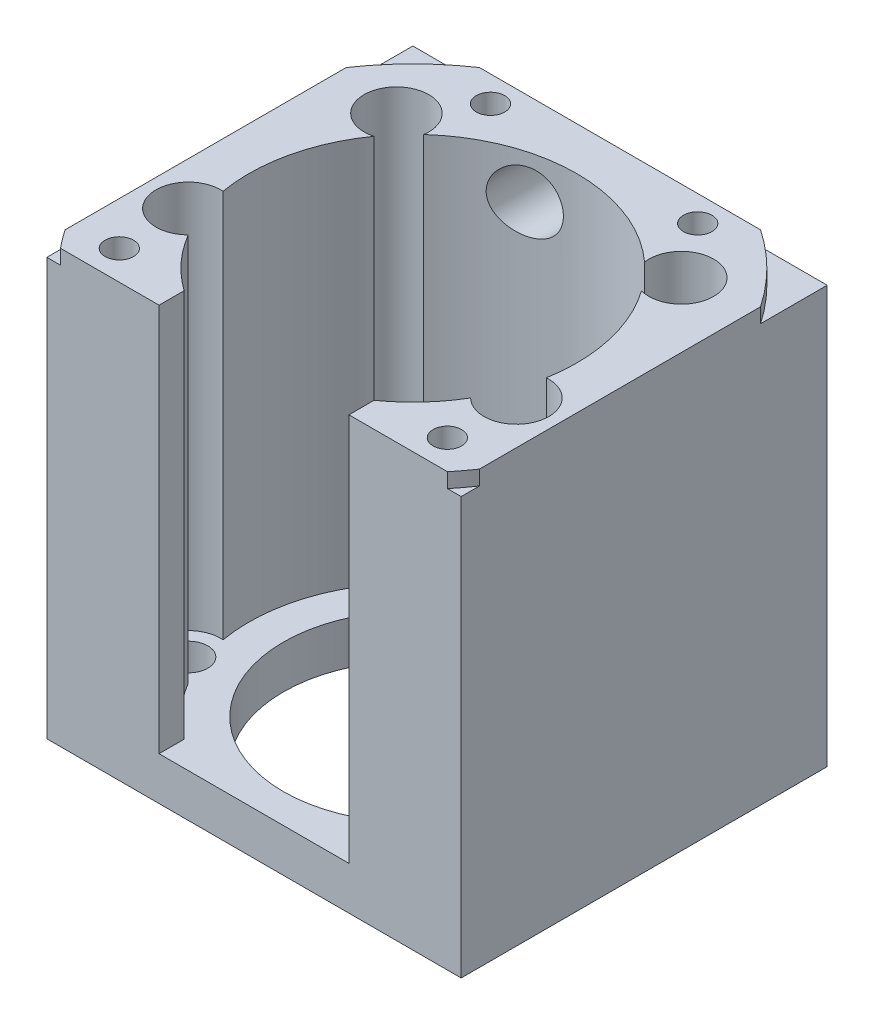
SolidWorks part; units mm, degrees
ref_plane "前视基准面" through (0, 0, 0) normal (0, 0, 1) x (1, 0, 0)
ref_plane "上视基准面" through (0, 0, 0) normal (0, 1, 0) x (1, 0, 0)
ref_plane "右视基准面" through (0, 0, 0) normal (1, 0, 0) x (0, 0, -1)
sketch "草图1" plane through (0, 0, 0) normal (0, 1, 0) x (1, 0, 0)
  line L1 (0, 0) -> (48, 0)
  line L2 (0, 0) -> (0, 42.4)
  line L3 (0, 42.4) -> (48, 42.4)
  line L4 (48, 0) -> (48, 42.4)
  dimension "D1" = 48
  dimension "D2" = 42.4
extrude "凸台-拉伸1" add sketch "草图1" along normal blind 50
sketch "草图2" plane through (0, 50, 0) normal (0, 1, 0) x (1, 0, 0)
  line L0 (24, 0) -> (24, 32.6408) construction
  line L1 (0, 0) -> (48, 0) construction
  circle A0 centre (24, 18.4) radius 15
  dimension "D1" = 18.4
  dimension "D2" = 30
extrude "切除-拉伸1" cut sketch "草图2" against normal blind 50
sketch "草图3" plane through (0, 50, 0) normal (0, 1, 0) x (1, 0, 0)
  circle A0 centre (24, 18.4) radius 19
  dimension "D1" = 38
extrude "切除-拉伸2" cut sketch "草图3" against normal blind 45
sketch "草图4" plane through (0, 50, 0) normal (0, 1, 0) x (1, 0, 0)
  line L0 (0, 0) -> (19.2629, 0) construction
  line L1 (13, 0) -> (35, 0)
  line L2 (13, 0) -> (13, 3.7953)
  line L3 (13, 3.7953) -> (35, 3.7953)
  line L4 (35, 0) -> (35, 3.7953)
  line L5 (24, 42.4) -> (24, -6.943) construction
  line L6 (48, 42.4) -> (0, 42.4) construction
  dimension "D1" = 22
extrude "切除-拉伸3" cut sketch "草图4" against normal blind 45
sketch "草图5" plane through (0, 50, 0) normal (0, 1, 0) x (1, 0, 0)
  line L0 (24, 42.4) -> (24, 18.4) construction
  line L1 (48, 42.4) -> (0, 42.4) construction
  line L2 (24, 18.4) -> (51.3541, 18.4) construction
  circle A0 centre (7.5, 33) radius 2.25
  circle A1 centre (5, 11.4) radius 2.25
  circle A2 centre (43, 11.4) radius 2.25
  circle A3 centre (40.5, 33) radius 2.25
  dimension "D1" = 14.6
  dimension "D2" = 4.5
  dimension "D3" = 33
  dimension "D4" = 7
  dimension "D5" = 38
extrude "切除-拉伸4" cut sketch "草图5" against normal blind 55
sketch "草图6" plane through (0, 50, 0) normal (0, 1, 0) x (1, 0, 0)
  circle A0 centre (7.5, 33) radius 3.75
  circle A1 centre (40.5, 33) radius 3.75
  circle A2 centre (5, 11.4) radius 3.75
  circle A3 centre (43, 11.4) radius 3.75
  dimension "D1" = 7.5
extrude "切除-拉伸5" cut sketch "草图6" against normal blind 45
sketch "草图7" plane through (0, 50, 0) normal (0, 1, 0) x (1, 0, 0)
  line L0 (24, 42.4) -> (24, -5.6) construction
  line L1 (48, 42.4) -> (0, 42.4) construction
  line L2 (12, 39.4) -> (36, 39.4)
  line L3 (5, 3.4) -> (43, 3.4)
  line L4 (24, 18.4) -> (52.8261, 18.4) construction
  circle A0 centre (24, 18.4) radius 15 construction
  dimension "D1" = 15
  dimension "D2" = 38
  dimension "D3" = 24
  dimension "D4" = 21
hole_wizard "M4 螺纹孔1" positions "草图9" profile "草图8" tap size "M4" standard "Iso"
sketch "草图9" plane through (0, 50, 0) normal (0, 1, 0) x (1, 0, 0)
  point P0 (12, 39.4)
  point P3 (36, 39.4)
  point P6 (5, 3.4)
  point P9 (43, 3.4)
sketch "草图8" plane through (12, 50, -39.4) normal (1, 0, 0) x (0, 0, 1)
  line L0 (0, 0) -> (0, 18.0914)
  line L1 (0, 18.0914) -> (1.65, 17.1)
  line L2 (1.65, 17.1) -> (1.65, 0)
  line L5 (1.65, 0) -> (0, 0)
  line L10 (0, 18.0914) -> (-1.65, 17.1) construction
  line L11 (0, -6.35) -> (0, 107.95) construction
  dimension "螺纹孔钻头直径" = 3.3
  dimension "螺纹孔钻头深度" = 17.1
  dimension "导头角度" = 118
sketch "草图10" plane through (0, 50, 0) normal (0, 1, 0) x (1, 0, 0)
  circle A0 centre (24, 18.4) radius 29
  dimension "D1" = 58
extrude "切除-拉伸6" cut sketch "草图10" against normal blind 1.7 flip side to cut
sketch "草图11" plane through (0, 0, -42.4) normal (0, 0, -1) x (-1, 0, 0)
  line L0 (-24, 0) -> (-24, 53.3114) construction
  line L1 (-48, 0) -> (0, 0) construction
  line L2 (-40.2788, 50) -> (-7.7212, 50) construction
  circle A0 centre (-19, 45) radius 3.5
  circle A1 centre (-34, 10) radius 3.5
  dimension "D1" = 10
  dimension "D3" = 7
  dimension "D4" = 20
  dimension "D5" = 7
  dimension "D6" = 10
  dimension "D2" = 5
extrude "切除-拉伸7" cut sketch "草图11" against normal blind 10
